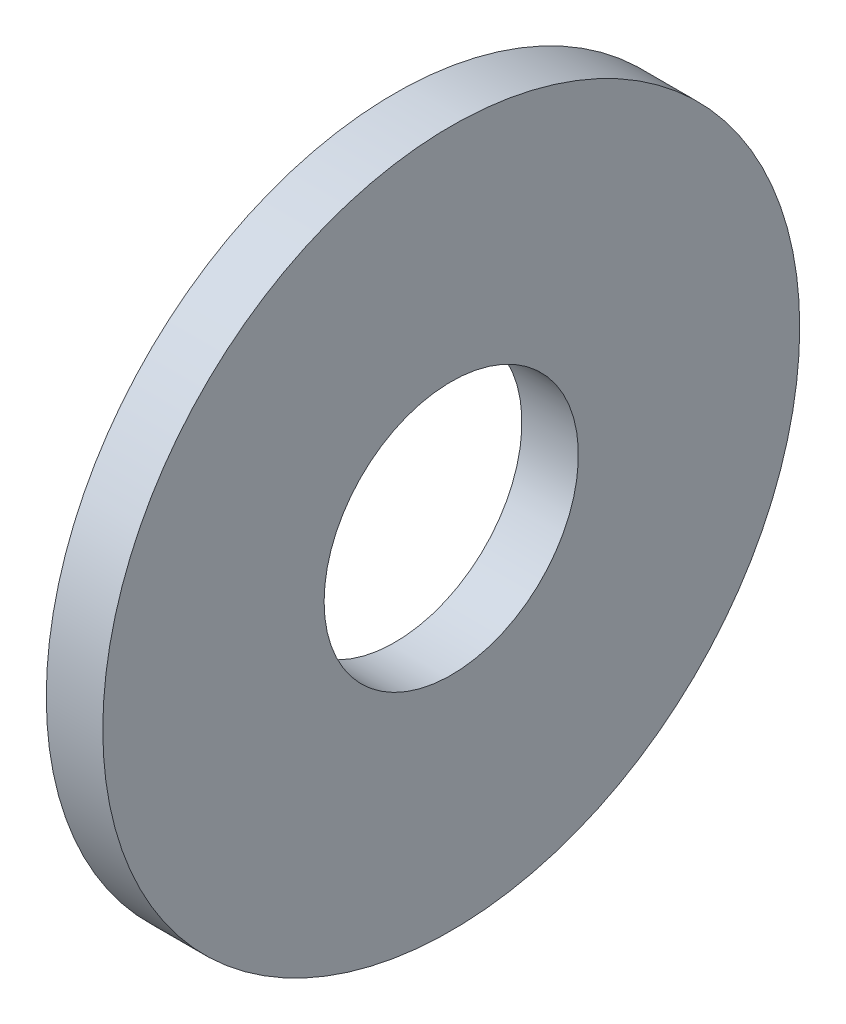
SolidWorks part; units mm, degrees
ref_plane "Plane1" through (0, 0, 0) normal (0, 0, 1) x (1, 0, 0)
ref_plane "Plane2" through (0, 0, 0) normal (0, 1, 0) x (1, 0, 0)
ref_plane "Plane3" through (0, 0, 0) normal (1, 0, 0) x (0, 0, -1)
sketch "Sketch1" plane through (0, 0, 0) normal (0, 0, 1) x (1, 0, 0)
  line L0 (-34.925, 0) -> (9.525, 0) construction
  line L1 (0, 6.75) -> (0, 18.5)
  line L2 (0, 18.5) -> (-3, 18.5)
  line L3 (-3, 18.5) -> (-3, 6.75)
  line L4 (-3, 6.75) -> (0, 6.75)
  dimension "Thickness" = 3
  dimension "Inside_dia" = 13.5
  dimension "Outside_dia" = 37
revolve "Base-Revolve" add sketch "Sketch1" angle 360 about L0
